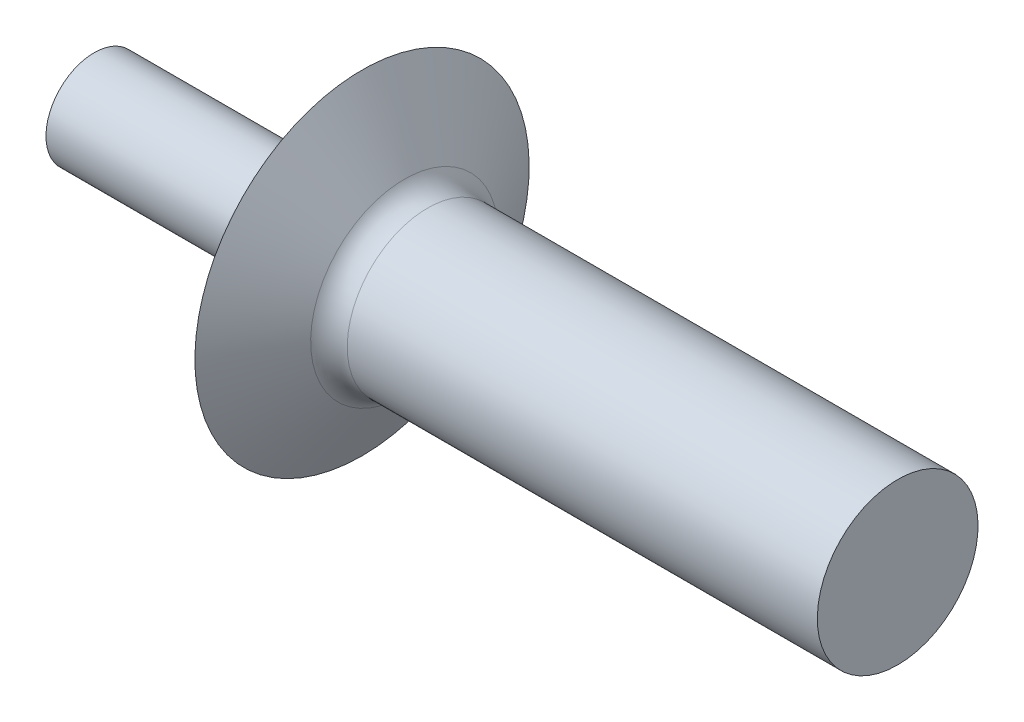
SolidWorks part; units mm, degrees
ref_plane "Front" through (0, 0, 0) normal (0, 0, 1) x (1, 0, 0)
ref_plane "Top" through (0, 0, 0) normal (0, 1, 0) x (1, 0, 0)
ref_plane "Right" through (0, 0, 0) normal (1, 0, 0) x (0, 0, -1)
sketch "Sketch1" plane through (23.9153, 20.7953, 0) normal (0, 0, 1) x (0, 1, 0)
  line L0 (-20.7953, 8.9153) -> (-19.2953, 8.9153)
  line L1 (-19.2953, 8.9153) -> (-19.2953, 17.98)
  line L2 (-19.2953, 17.98) -> (-17.6753, 18.9153)
  line L3 (-17.6753, 18.9153) -> (-19.8953, 18.9153)
  line L4 (-19.8953, 18.9153) -> (-19.8953, 23.9153)
  line L5 (-20.7953, 51.1695) -> (-20.7953, -6.4589) construction
  line L6 (-19.8953, 23.9153) -> (-20.7953, 23.9153)
  line L7 (-20.7953, 23.9153) -> (-20.7953, 8.9153)
  dimension "l" = 10
  dimension "d" = 3
  dimension "dk" = 6.24
  dimension "d1" = 1.8
  dimension "D5" = 60
  dimension "l1" = 5
revolve "Base-Revolve" add sketch "Sketch1" angle 360 about L5
fillet "Fillet1" radius 0.5 1 edges at (5.9353, -1.5, 0)
equation "\"l1@Sketch1\" = \"l@Sketch1\" / 2"
